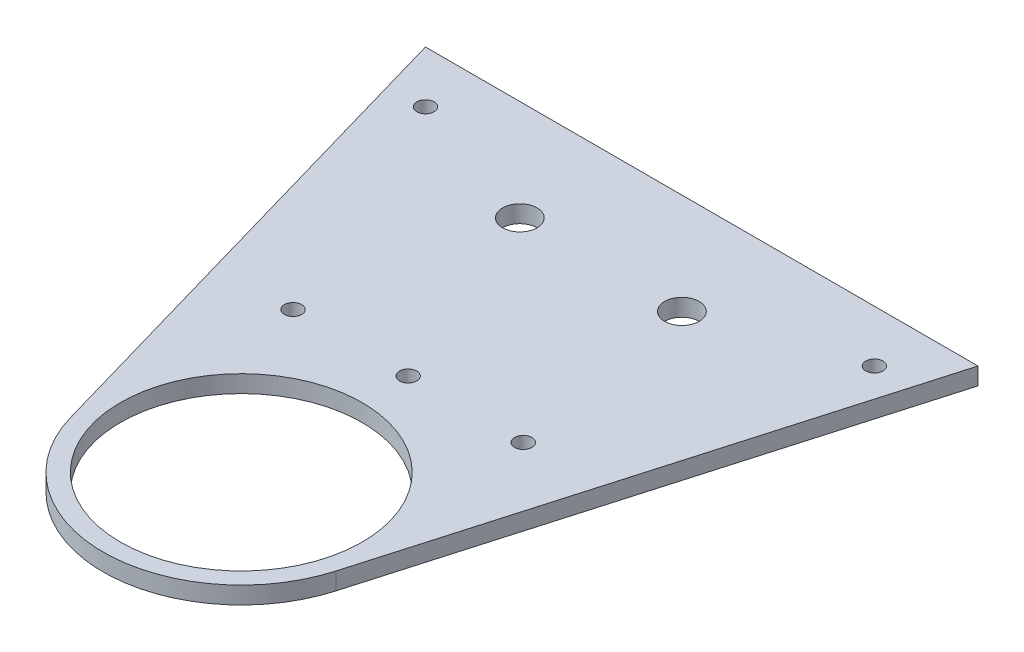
SolidWorks part; units mm, degrees
ref_plane "前视基准面" through (0, 0, 0) normal (0, 0, 1) x (1, 0, 0)
ref_plane "上视基准面" through (0, 0, 0) normal (0, 1, 0) x (1, 0, 0)
ref_plane "右视基准面" through (0, 0, 0) normal (1, 0, 0) x (0, 0, -1)
sketch "草图1" plane through (0, 0, 0) normal (0, 1, 0) x (1, 0, 0)
  line L1 (0, 80) -> (-48, 80)
  line L2 (-48, 80) -> (-23.0637, -6.6382)
  line L3 (0, 80) -> (48, 80)
  line L4 (48, 80) -> (23.0637, -6.6382)
  circle A0 centre (0, 0) radius 21
  arc A1 (-23.0637, -6.6382) -> (23.0637, -6.6382) centre (0, 0) ccw
  dimension "D1" = 80
  dimension "D2" = 42
extrude "凸台-拉伸1" add sketch "草图1" along normal blind 3
sketch "草图4" plane through (0, 3, 0) normal (0, 1, 0) x (1, 0, 0)
  circle A0 centre (-14.0911, 62.4906) radius 3
  circle A1 centre (14.0612, 62.4906) radius 3
extrude "切除-拉伸3" cut sketch "草图4" against normal blind 36
sketch "草图5" plane through (0, 0, 0) normal (0, -1, 0) x (1, 0, 0)
  line L0 (48, -80) -> (-48, -80) construction
  circle A0 centre (0, -28.9899) radius 1.5
  circle A1 centre (20, -28.9899) radius 1.5
  circle A2 centre (-20, -28.9899) radius 1.5
  circle A3 centre (39, -71) radius 1.5
  circle A4 centre (-39, -71) radius 1.5
  dimension "D1" = 20
  dimension "D2" = 20
  dimension "D3" = 9
  dimension "D4" = 9
  dimension "D5" = 9
  dimension "D6" = 9
extrude "切除-拉伸5" cut sketch "草图5" against normal blind 10
